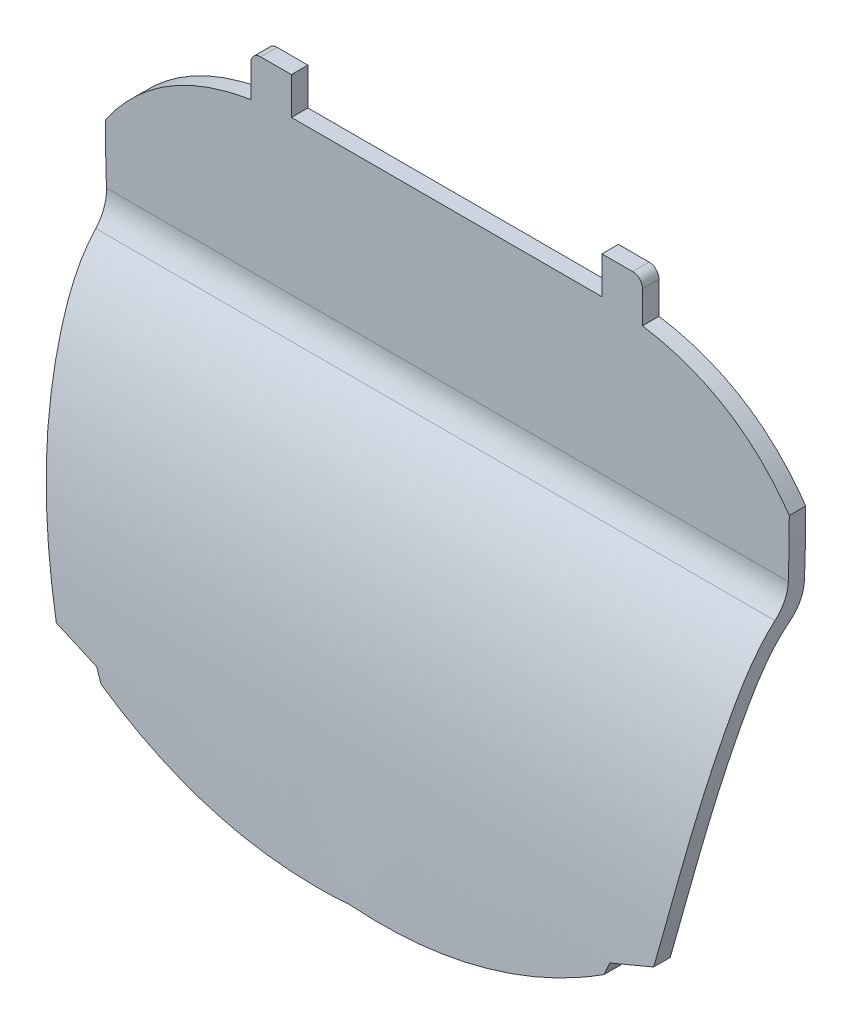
SolidWorks part; units mm, degrees
ref_plane "Plan de face" through (0, 0, 0) normal (0, 0, 1) x (1, 0, 0)
ref_plane "Plan de dessus" through (0, 0, 0) normal (0, 1, 0) x (1, 0, 0)
ref_plane "Plan de droite" through (0, 0, 0) normal (1, 0, 0) x (0, 0, -1)
sketch "Esquisse1" plane through (0, 0, 0) normal (1, 0, 0) x (0, 0, -1)
  line L0 (-36.3155, 25.9757) -> (-36.3155, 28.7071)
  line L1 (-36.3155, 28.7071) -> (-36.3155, 62.4396)
  line L2 (-33.8155, 62.4396) -> (-36.3155, 62.4396)
  line L3 (-48.8155, -35.5113) -> (-51.3098, -35.5113)
  line L4 (-51.3098, -35.5113) -> (-51.3098, -35.3427)
  line L5 (-33.8155, 28.7071) -> (-33.8155, 62.4396)
  line L6 (-33.8155, 24.6133) -> (-33.8155, 28.7071)
  line L7 (-53.0519, -35.5113) -> (-48.8155, -35.5113)
  line L8 (-54.0539, 62.4396) -> (-53.0519, -35.5113)
  line L9 (-33.8155, 62.4396) -> (-54.0539, 62.4396)
  line L10 (-33.8155, 28.7071) -> (-33.8155, 62.4396)
  line L11 (-33.8155, 24.6133) -> (-33.8155, 28.7071)
  spline S0 degree 1 poles (-51.3098, -35.3427) (-36.3155, 25.9757) knots 0 0 1 1 construction
  spline S1 degree 3 poles (-4032.2604, -160.6238) (347.01, -310.3862) (-263.9364, -55.0087) (70.7183, 112.1291) (2367.1432, -3170.4198) knots -6.034248 -6.034248 -6.034248 -6.034248 0.779502 3.370452 3.370452 3.370452 3.370452 only from (-48.8155, -35.5113) to (-33.8155, 24.6133)
  spline S2 degree 3 poles (-48.8155, -35.5113) (-47.6994, -19.0016) (-48.1491, 2.1327) (-37.9078, 22.2693) (-33.8155, 24.6133) knots 0 0 0 0 0.779502 1 1 1 1
  spline S3 degree 3 poles (-51.3098, -35.3427) (-51.1354, -32.7634) (-50.8589, -27.6099) (-50.472, -19.8202) (-49.9272, -12.0071) (-49.0331, -4.1781) (-47.8329, 2.3452) (-46.5028, 7.5511) (-45.2904, 11.4488) (-43.86, 15.3216) (-42.0921, 19.2438) (-40.1187, 22.3371) (-38.1171, 24.5426) (-36.9351, 25.5328) (-36.3155, 25.9757) knots 0 0 0 0 0.122556 0.245112 0.367668 0.490223 0.612779 0.674057 0.735335 0.796613 0.857891 0.919169 0.949808 0.980447 0.980447 0.980447 0.980447
  dimension "D1" = 0
  dimension "D2" = 2.5
extrude "Boss.-Extru.1" add sketch "Esquisse1" along normal blind 30 and the other way blind 90
fillet "Congé1" radius 6 1 edges at (-30, 24.6133, 33.8155)
sketch "Esquisse2" plane through (0, 0, 33.8155) normal (0, 0, -1) x (-1, 0, 0)
  line L0 (52.1862, 52.0736) -> (5.0581, 52.0736)
  line L1 (5.0581, 52.0736) -> (5.0581, 57.7071)
  line L2 (5.0581, 57.7071) -> (0.3909, 57.7071)
  line L3 (-1.1091, 56.2071) -> (-1.1091, 51.3368)
  line L4 (-16.8261, -18.091) -> (-10.3135, -20.7346)
  line L5 (-10.3135, -20.7346) -> (-9.5603, -22.5872)
  line L6 (66.8046, -22.5872) -> (67.5578, -20.7346)
  line L7 (67.5578, -20.7346) -> (73.85, -18.1805)
  line L8 (58.3534, 51.3368) -> (58.3534, 56.2071)
  line L9 (56.8534, 57.7071) -> (52.1862, 57.7071)
  line L10 (52.1862, 57.7071) -> (52.1862, 52.0736)
  arc A0 (0.3909, 57.7071) -> (-1.1091, 56.2071) centre (0.3909, 56.2071) ccw
  arc A1 (58.3534, 56.2071) -> (56.8534, 57.7071) centre (56.8534, 56.2071) ccw
  spline S6 degree 3 poles (-1.1091, 51.3368) (-1.7075, 51.2403) (-2.9105, 51.0193) (-5.2127, 50.4863) (-7.9573, 49.6419) (-11.027, 48.3495) (-13.888, 46.7773) (-16.5496, 44.9223) (-19.0206, 42.7785) (-20.9283, 40.7411) (-22.3604, 38.9625) (-23.0528, 38.0118) (-23.3852, 37.5322) knots 0.499051 0.499051 0.499051 0.499051 0.499158 0.499265 0.49948 0.499695 0.49991 0.500125 0.50034 0.500555 0.500662 0.500769 0.500769 0.500769 0.500769
  spline S7 degree 3 poles (-23.3852, 37.5322) (-23.3899, 32.8496) (-23.1238, 23.4688) (-21.897, 9.5246) (-19.8462, -4.3278) (-17.9205, -13.5307) (-16.8261, -18.091) knots 0.499396 0.499396 0.499396 0.499396 0.499721 0.500045 0.50037 0.500694 0.500694 0.500694 0.500694
  spline S8 degree 3 poles (-9.5603, -22.5872) (-8.8283, -23.0469) (-7.3405, -23.9437) (-4.3561, -25.5927) (-0.5686, -27.4093) (4.0577, -29.1933) (8.7729, -30.5864) (13.5791, -31.59) (18.4869, -32.2045) (23.481, -32.4308) (26.9209, -32.3185) (28.6222, -32.1993) knots 0.499059 0.499059 0.499059 0.499059 0.499172 0.499286 0.499513 0.49974 0.499967 0.500194 0.500421 0.500648 0.500875 0.500875 0.500875 0.500875
  spline S9 degree 3 poles (28.6222, -32.1993) (29.4798, -32.2621) (31.2053, -32.356) (34.5985, -32.4101) (38.7787, -32.2312) (43.6868, -31.6227) (48.4952, -30.6214) (53.2083, -29.2262) (57.8302, -27.4358) (61.6118, -25.6102) (64.5901, -23.952) (66.0745, -23.0497) (66.8046, -22.5872) knots 0.499103 0.499103 0.499103 0.499103 0.499218 0.499333 0.499562 0.499792 0.500022 0.500252 0.500482 0.500711 0.500826 0.500941 0.500941 0.500941 0.500941
  spline S10 degree 3 poles (73.85, -18.1805) (74.9474, -13.6021) (76.8782, -4.3626) (78.9333, 9.5446) (80.1611, 23.5437) (80.4257, 32.9613) (80.4197, 37.6623) knots 0.499306 0.499306 0.499306 0.499306 0.49963 0.499955 0.500279 0.500604 0.500604 0.500604 0.500604
  spline S11 degree 3 poles (80.4197, 37.6623) (80.0904, 38.1373) (79.4046, 39.0791) (77.986, 40.8409) (76.0963, 42.8591) (73.6485, 44.9827) (71.012, 46.8203) (68.1779, 48.3776) (65.1371, 49.6579) (62.4184, 50.4943) (60.1379, 51.0222) (58.9462, 51.2412) (58.3534, 51.3368) knots 0.499231 0.499231 0.499231 0.499231 0.499338 0.499445 0.49966 0.499875 0.50009 0.500305 0.50052 0.500735 0.500842 0.500949 0.500949 0.500949 0.500949
extrude "Enlèv. mat.-Extru.2" cut sketch "Esquisse2" against normal through all flip side to cut
fillet "Congé2" radius 6 1 edges at (-28.5163, 25.9757, 36.3155)
